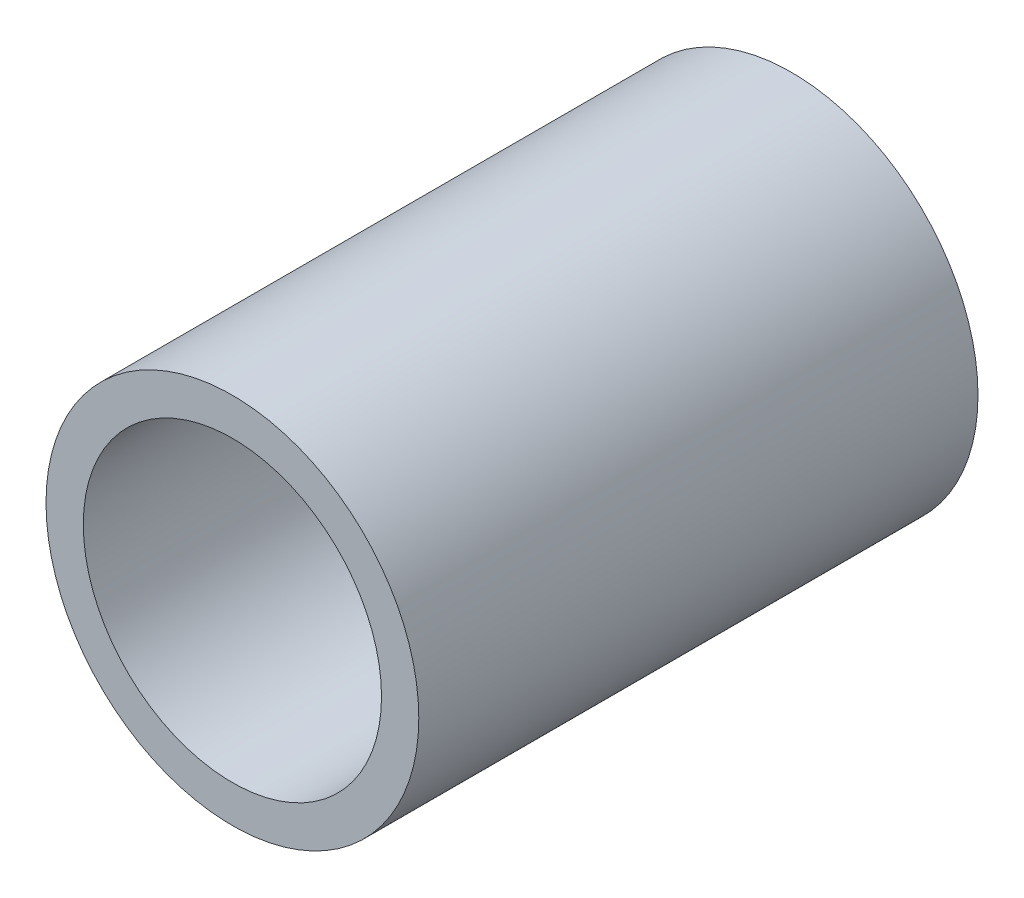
SolidWorks part; units mm, degrees
ref_plane "Front Plane" through (0, 0, 0) normal (0, 0, 1) x (1, 0, 0)
ref_plane "Top Plane" through (0, 0, 0) normal (0, 1, 0) x (1, 0, 0)
ref_plane "Right Plane" through (0, 0, 0) normal (1, 0, 0) x (0, 0, -1)
sketch "Sketch1" plane through (0, 0, 0) normal (0, 0, 1) x (1, 0, 0)
  circle A0 centre (0, 0) radius 50
  circle A1 centre (0, 0) radius 40
  dimension "D1" = 100
  dimension "D2" = 80
extrude "Boss-Extrude1" add sketch "Sketch1" along normal blind 150
